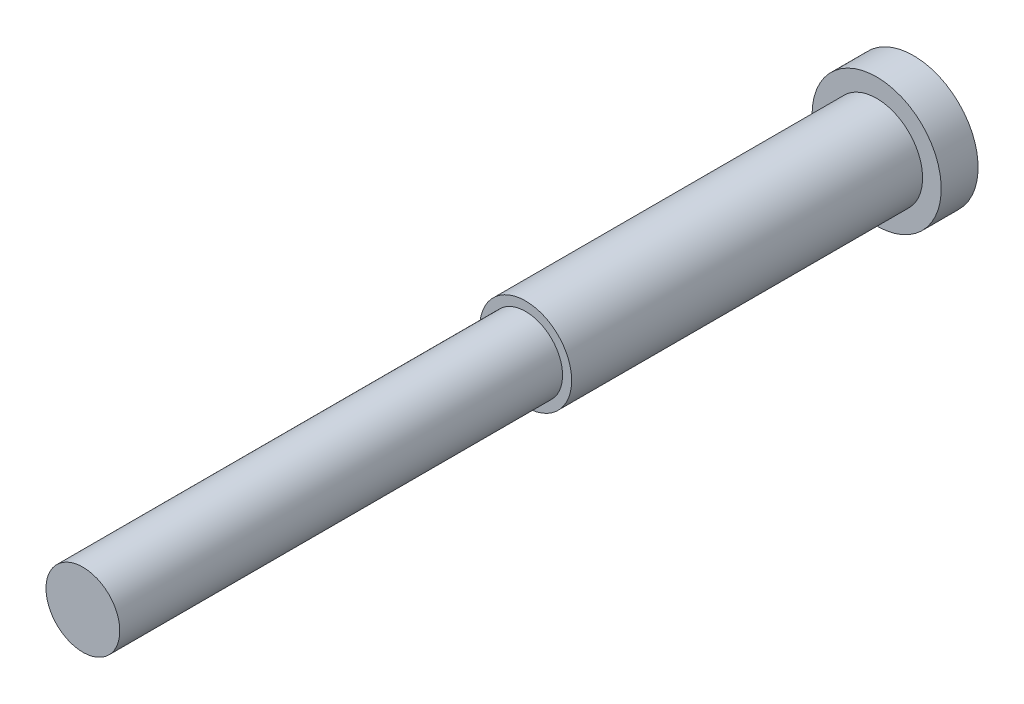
SolidWorks part; units mm, degrees
ref_plane "Front" through (0, 0, 0) normal (0, 0, 1) x (1, 0, 0)
ref_plane "Top" through (0, 0, 0) normal (0, 1, 0) x (1, 0, 0)
ref_plane "Right" through (0, 0, 0) normal (1, 0, 0) x (0, 0, -1)
sketch "Sketch1" plane through (0, 0, 0) normal (0, 0, 1) x (1, 0, 0)
  circle A0 centre (0, 0) radius 7.9121
  dimension "D1" = 15.8242
extrude "Base-Extrude" add sketch "Sketch1" along normal blind 60.4012
sketch "Sketch2" plane through (0, 0, 60.4012) normal (0, 0, 1) x (1, 0, 0)
  circle A0 centre (0, 0) radius 6.35
  dimension "D1" = 12.7
extrude "Boss-Extrude1" add sketch "Sketch2" along normal blind 76.2
sketch "Sketch3" plane through (0, 0, 0) normal (0, 0, -1) x (-1, 0, 0)
  circle A0 centre (0, 0) radius 11.1125
  dimension "D1" = 22.225
extrude "Boss-Extrude2" add sketch "Sketch3" along normal blind 6.35
ref_plane "Place" through (0, 0, 53.34) normal (0, 0, 1) x (1, 0, 0)
